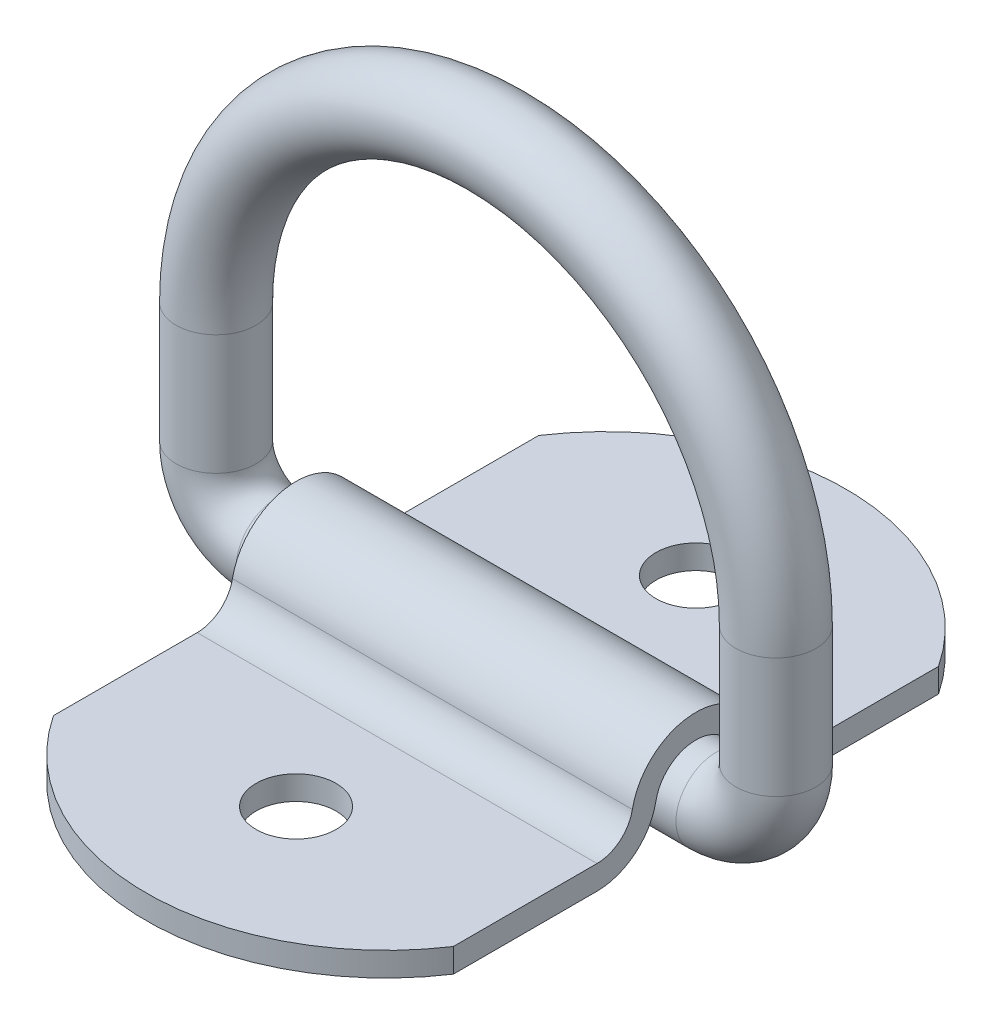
SolidWorks part; units mm, degrees
ref_plane "Front Plane" through (0, 0, 0) normal (0, 0, 1) x (1, 0, 0)
ref_plane "Top Plane" through (0, 0, 0) normal (0, 1, 0) x (1, 0, 0)
ref_plane "Right Plane" through (0, 0, 0) normal (1, 0, 0) x (0, 0, -1)
sketch "Sketch1" plane through (0, 0, 0) normal (0, 0, 1) x (1, 0, 0)
  line L1 (0, 0) -> (0, 39.6875) construction
  line L2 (-25.4, 14.2875) -> (-25.4, 4.7625) construction
  line L3 (-19.05, 14.2875) -> (-19.05, 3.175) construction
  line L4 (19.05, 14.2875) -> (19.05, 3.175) construction
  line L5 (25.4, 14.2875) -> (25.4, 4.7625) construction
  line L6 (19.05, 3.175) -> (-19.05, 3.175) construction
  line L7 (17.4625, -3.175) -> (-25.4, -3.175) construction
  line L8 (0, 3.175) -> (0, -3.175) construction
  line L10 (-22.225, 14.2875) -> (-22.225, 4.7625)
  line L11 (22.225, 14.2875) -> (22.225, 4.7625)
  line L12 (-17.4625, 0) -> (17.4625, 0)
  line L13 (-25.4, 4.7625) -> (-25.4, -3.175) construction
  arc A0 (25.4, 14.2875) -> (-25.4, 14.2875) centre (0, 14.2875) ccw construction
  arc A1 (19.05, 14.2875) -> (-19.05, 14.2875) centre (0, 14.2875) ccw construction
  circle A2 centre (0, 36.5125) radius 3.175 construction
  circle A3 centre (0, 0) radius 3.175 construction
  arc A4 (22.225, 14.2875) -> (-22.225, 14.2875) centre (0, 14.2875) ccw
  arc A5 (-17.4625, 0) -> (-22.225, 4.7625) centre (-17.4625, 4.7625) cw
  arc A6 (17.4625, 0) -> (22.225, 4.7625) centre (17.4625, 4.7625) ccw
  arc A7 (-17.4625, 3.175) -> (-19.05, 4.7625) centre (-17.4625, 4.7625) cw construction
  arc A8 (-17.4625, -3.175) -> (-25.4, 4.7625) centre (-17.4625, 4.7625) cw construction
  arc A9 (17.4625, -3.175) -> (25.4, 4.7625) centre (17.4625, 4.7625) ccw construction
  dimension "C" = 6.35
  dimension "D1" = 4.7625
  dimension "A" = 38.1
  dimension "B" = 42.8625
sketch "Sketch2" plane through (0, 0, 0) normal (1, 0, 0) x (0, 0, -1)
  circle A0 centre (0, 0) radius 3.175
sweep "Sweep1" add profiles "Sketch2" path "Sketch1"
sketch "Sketch3" plane through (0, 0, 0) normal (1, 0, 0) x (0, 0, -1)
  line L0 (-27.7812, -3.2385) -> (27.7812, -3.2385) construction
  line L1 (-27.7812, -3.2385) -> (-27.7812, -1.3335)
  line L2 (-27.7812, -1.3335) -> (27.7812, -1.3335) construction
  line L3 (0, 0) -> (0, -3.2385) construction
  line L4 (27.7812, -3.2385) -> (27.7812, -1.3335)
  line L5 (-27.7812, -3.2385) -> (-7.8545, -3.2385)
  line L6 (-27.7812, -1.3335) -> (-7.8545, -1.3335)
  line L7 (-15.875, -3.2385) -> (-15.875, -1.3335) construction
  line L8 (27.7812, -3.2385) -> (7.8545, -3.2385)
  line L9 (27.7812, -1.3335) -> (7.8545, -1.3335)
  arc A0 (-7.8545, -3.2385) -> (-3.1792, 0.6169) centre (-7.8545, 1.524) ccw
  arc A1 (-3.1792, 0.6169) -> (3.1792, 0.6169) centre (0, 0) cw
  arc A2 (-7.8545, -1.3335) -> (-5.0493, 0.9797) centre (-7.8545, 1.524) ccw
  arc A3 (-5.0493, 0.9797) -> (5.0493, 0.9797) centre (0, 0) cw
  arc A4 (7.8545, -1.3335) -> (5.0493, 0.9797) centre (7.8545, 1.524) cw
  arc A5 (7.8545, -3.2385) -> (3.1792, 0.6169) centre (7.8545, 1.524) cw
  circle A6 centre (0, 0) radius 3.2385 construction
  dimension "D1" = 31.75
  dimension "D4" = 6.477
  dimension "D5" = 4.7625
  dimension "D2" = 1.905
  dimension "D3" = 55.5625
extrude "Boss-Extrude1" add sketch "Sketch3" along normal mid plane 31.75 separate body
sketch "Sketch4" plane through (0, -3.2385, 0) normal (0, -1, 0) x (1, 0, 0)
  line L0 (-15.875, 19.2615) -> (-15.875, 27.7812)
  line L1 (-15.875, 27.7812) -> (-15.875, 28.0353)
  line L2 (-15.875, 28.0353) -> (15.875, 28.0353)
  line L3 (15.875, 28.0353) -> (15.875, 27.7812)
  line L4 (15.875, 27.7812) -> (15.875, 19.2615)
  line L5 (0, 8.7312) -> (0, 0) construction
  line L6 (15.875, 27.7812) -> (-15.875, 27.7812) construction
  line L7 (-15.875, 0) -> (15.875, 0) construction
  line L8 (15.875, -27.7812) -> (15.875, -19.2615)
  line L9 (15.875, -28.0352) -> (15.875, -27.7812)
  line L10 (-15.875, -28.0353) -> (15.875, -28.0352)
  line L11 (-15.875, -27.7812) -> (-15.875, -28.0353)
  line L12 (-15.875, -19.2615) -> (-15.875, -27.7812)
  arc A0 (15.875, 19.2615) -> (-15.875, 19.2615) centre (0, 8.7312) ccw
  circle A1 centre (0, 15.875) radius 3.175
  circle A2 centre (0, -15.875) radius 3.175
  arc A3 (15.875, -19.2615) -> (-15.875, -19.2615) centre (0, -8.7312) cw
  dimension "D1" = 19.05
  dimension "D3" = 6.35
  dimension "D4" = 8.5197
  dimension "D2" = 0.254
extrude "Cut-Extrude1" cut sketch "Sketch4" against normal through all
